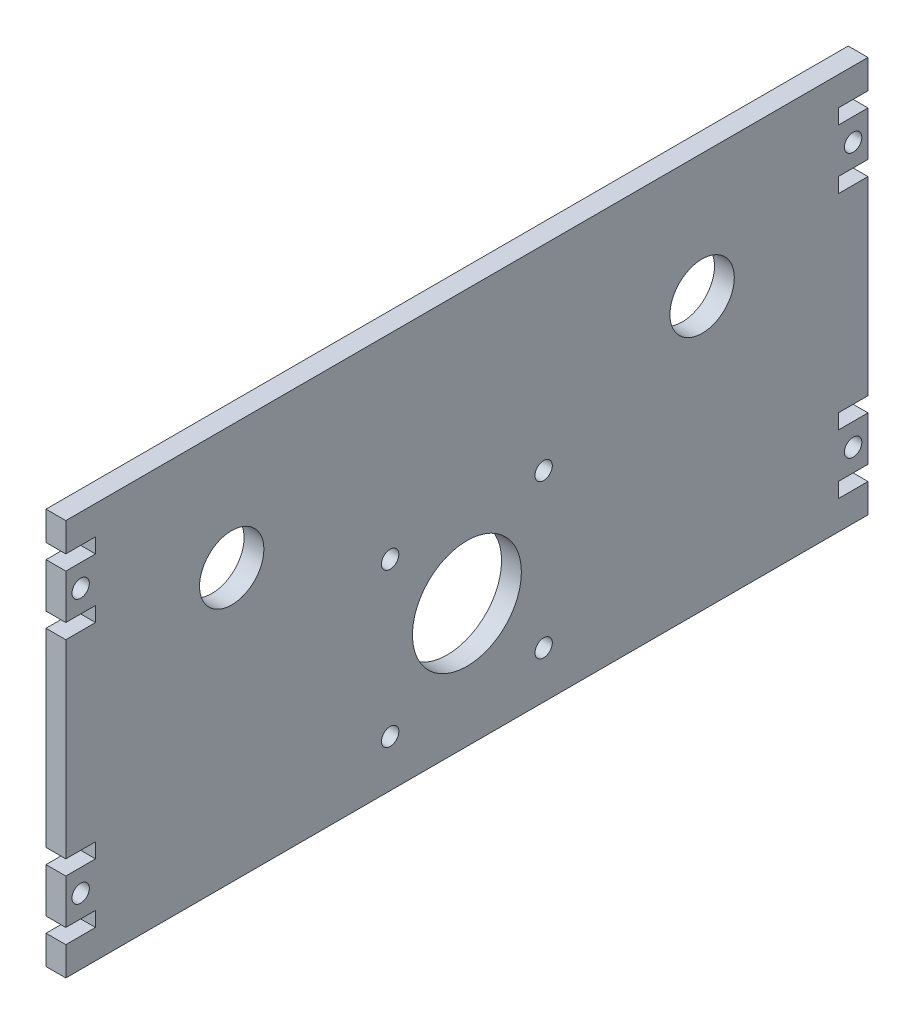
SolidWorks part; units mm, degrees
ref_plane "Front Plane" through (0, 0, 0) normal (0, 0, 1) x (1, 0, 0)
ref_plane "Top Plane" through (0, 0, 0) normal (0, 1, 0) x (1, 0, 0)
ref_plane "Right Plane" through (0, 0, 0) normal (1, 0, 0) x (0, 0, -1)
sketch "Sketch1" plane through (0, 0, 0) normal (1, 0, 0) x (0, 0, -1)
  line L1 (81, -40) -> (-81, -40)
  line L2 (81, -40) -> (81, 40)
  line L3 (81, 40) -> (-81, 40)
  line L4 (-81, -40) -> (-81, 40)
  line L5 (81, -40) -> (-81, 40) construction
  line L6 (81, 40) -> (-81, -40) construction
  point P0 (0, 0)
  dimension "D1" = 162
  dimension "D2" = 80
extrude "Boss-Extrude1" add sketch "Sketch1" along normal mid plane 4
sketch "Sketch2" plane through (2, 0, 0) normal (1, 0, 0) x (0, 0, -1)
  line L0 (0, -40) -> (0, 15) construction
  line L1 (-81, -40) -> (81, -40) construction
  line L2 (47.5, 15) -> (-47.5, 15) construction
  line L3 (0, -40) -> (0, -15) construction
  line L5 (15.5, -30.5) -> (-15.5, -30.5) construction
  line L6 (15.5, -30.5) -> (15.5, 0.5) construction
  line L7 (15.5, 0.5) -> (-15.5, 0.5) construction
  line L8 (-15.5, -30.5) -> (-15.5, 0.5) construction
  line L9 (15.5, -30.5) -> (-15.5, 0.5) construction
  line L10 (15.5, 0.5) -> (-15.5, -30.5) construction
  circle A0 centre (-47.5, 15) radius 6.5
  circle A1 centre (47.5, 15) radius 6.5
  circle A2 centre (0, -15) radius 11
  circle A3 centre (-15.5, 0.5) radius 1.75
  circle A4 centre (-15.5, -30.5) radius 1.75
  circle A5 centre (15.5, -30.5) radius 1.75
  circle A6 centre (15.5, 0.5) radius 1.75
  point P8 (0, 15)
  dimension "D3" = 13
  dimension "D4" = 22
  dimension "D8" = 3.5
  dimension "D1" = 55
  dimension "D2" = 95
  dimension "D5" = 25
  dimension "D6" = 31
  dimension "D7" = 31
extrude "Cut-Extrude1" cut sketch "Sketch2" against normal through all
sketch "Sketch3" plane through (2, 0, 0) normal (1, 0, 0) x (0, 0, -1)
  line L0 (0, 0) -> (0, 40) construction
  line L1 (81, 40) -> (-81, 40) construction
  line L2 (-81, 40) -> (-75, 40) construction
  line L3 (-81, 40) -> (-81, -40) construction
  line L4 (-81, 0) -> (0, 0) construction
  line L5 (-78, 40) -> (-78, -40) construction
  line L6 (-81, -40) -> (81, -40) construction
  line L7 (-75, 40) -> (-75, -40) construction
  line L8 (-78, 26.6667) -> (-75, 26.6667) construction
  line L9 (-81, 34.1667) -> (-75, 34.1667)
  line L10 (-81, 34.1667) -> (-81, 31.1667)
  line L11 (-81, 31.1667) -> (-75, 31.1667)
  line L12 (-75, 34.1667) -> (-75, 31.1667)
  line L13 (-81, 22.1667) -> (-75, 22.1667)
  line L14 (-75, 19.1667) -> (-75, 22.1667)
  line L15 (-81, 19.1667) -> (-75, 19.1667)
  line L16 (-81, 19.1667) -> (-81, 22.1667)
  line L17 (-81, -19.1667) -> (-81, -22.1667)
  line L18 (-81, -19.1667) -> (-75, -19.1667)
  line L19 (-75, -19.1667) -> (-75, -22.1667)
  line L20 (-81, -22.1667) -> (-75, -22.1667)
  line L21 (-81, -31.1667) -> (-75, -31.1667)
  line L22 (-75, -34.1667) -> (-75, -31.1667)
  line L23 (-81, -34.1667) -> (-75, -34.1667)
  line L24 (-81, -34.1667) -> (-81, -31.1667)
  line L25 (81, -34.1667) -> (81, -31.1667)
  line L26 (81, -34.1667) -> (75, -34.1667)
  line L27 (75, -34.1667) -> (75, -31.1667)
  line L28 (81, -31.1667) -> (75, -31.1667)
  line L29 (81, -19.1667) -> (75, -19.1667)
  line L30 (75, -19.1667) -> (75, -22.1667)
  line L31 (81, -22.1667) -> (75, -22.1667)
  line L32 (81, -19.1667) -> (81, -22.1667)
  line L33 (81, 19.1667) -> (81, 22.1667)
  line L34 (81, 19.1667) -> (75, 19.1667)
  line L35 (75, 19.1667) -> (75, 22.1667)
  line L36 (81, 22.1667) -> (75, 22.1667)
  line L37 (81, 31.1667) -> (75, 31.1667)
  line L38 (75, 34.1667) -> (75, 31.1667)
  line L39 (81, 34.1667) -> (75, 34.1667)
  line L40 (81, 34.1667) -> (81, 31.1667)
  circle A0 centre (-78, 26.6667) radius 1.75
  circle A1 centre (-78, -26.6667) radius 1.75
  circle A2 centre (78, -26.6667) radius 1.75
  circle A3 centre (78, 26.6667) radius 1.75
  point P19 (-75, 32.6667)
extrude "Cut-Extrude2" cut sketch "Sketch3" against normal through all
equation "\"D6@Sketch3\"=(\"D5@Sketch3\"/3)/2"
